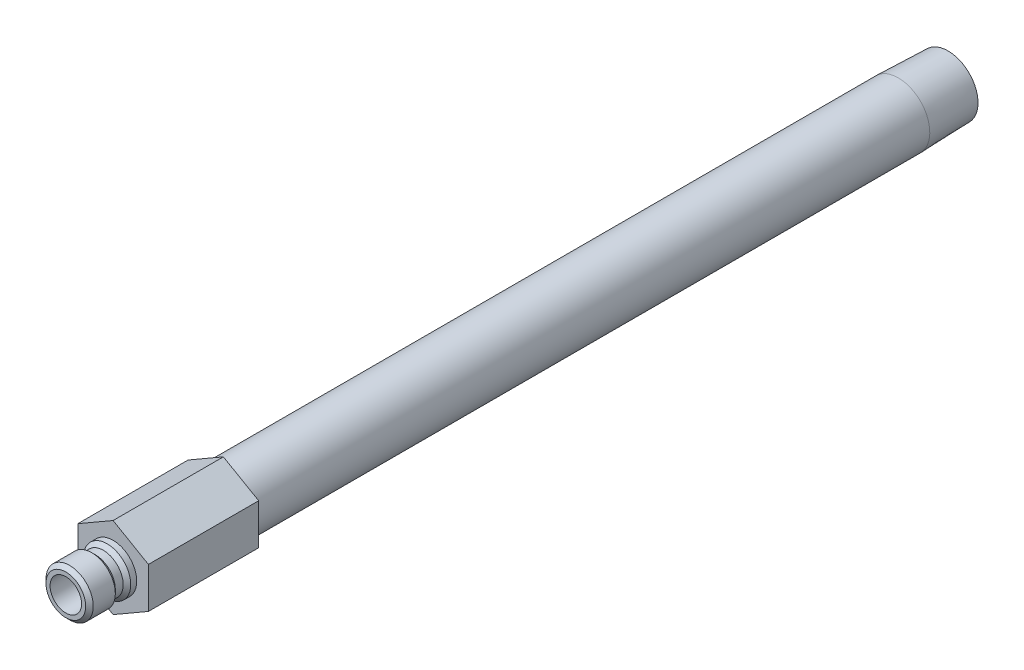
SolidWorks part; units mm, degrees
ref_plane "Front Plane" through (0, 0, 0) normal (0, 0, 1) x (1, 0, 0)
ref_plane "Top Plane" through (0, 0, 0) normal (0, 1, 0) x (1, 0, 0)
ref_plane "Right Plane" through (0, 0, 0) normal (1, 0, 0) x (0, 0, -1)
sketch "Sketch1" plane through (0, 0, 0) normal (1, 0, 0) x (0, 0, -1)
  line L0 (0, 0) -> (-12.7, 0) construction
  line L1 (-9.525, 3.175) -> (-9.525, 4.0005)
  line L2 (-3.556, 4.0005) -> (-3.556, 0) construction
  line L3 (-8.763, 4.7625) -> (-4.318, 4.7625)
  line L4 (0, 6.35) -> (0, 0) construction
  line L5 (-3.556, 4.0005) -> (-1.9685, 4.0005)
  line L6 (-1.2065, 4.7625) -> (0, 4.7625)
  line L7 (0, 4.7625) -> (0, 6.35)
  line L8 (-3.556, 4.0005) -> (-4.318, 4.7625)
  line L9 (-1.9685, 4.0005) -> (-1.2065, 4.7625)
  line L10 (-9.525, 4.0005) -> (-8.763, 4.7625)
  line L11 (22.225, 4.6228) -> (168.275, 4.6228)
  line L12 (0, 6.35) -> (158.242, 6.35)
  line L13 (158.242, 6.35) -> (168.275, 6.0365)
  line L14 (168.275, 6.0365) -> (168.275, 4.6228)
  line L15 (0, 0) -> (22.225, 0) construction
  line L16 (22.225, 0) -> (22.225, 4.7625) construction
  line L17 (22.225, 4.7625) -> (0, 4.7625) construction
  line L18 (22.225, 4.6228) -> (22.225, 3.175)
  line L19 (22.225, 3.175) -> (-9.525, 3.175)
  dimension "D1" = 9.525
  dimension "D2" = 1.5875
  dimension "D3" = 0.762
  dimension "D4" = 45
  dimension "D5" = 5.969
  dimension "D6" = 45
  dimension "D7" = 1.79
  dimension "D8" = 10.033
  dimension "D9" = 177.8
  dimension "D10" = 3.175
  dimension "D11" = 31.75
  dimension "D12" = 9.2456
  dimension "D13" = 6.35
  dimension "D14" = 9.525
  dimension "D15" = 12.7
revolve "Revolve1" add sketch "Sketch1" angle 360 about L0
sketch "Sketch2" plane through (0, 0, 0) normal (0, 0, 1) x (1, 0, 0)
  line L1 (-7.112, 4.1061) -> (-7.112, -4.1061)
  line L2 (-7.112, -4.1061) -> (0, -8.2122)
  line L3 (0, -8.2122) -> (7.112, -4.1061)
  line L4 (7.112, -4.1061) -> (7.112, 4.1061)
  line L5 (7.112, 4.1061) -> (0, 8.2122)
  line L6 (0, 8.2122) -> (-7.112, 4.1061)
  circle A0 centre (0, 0) radius 7.112 construction
  circle A1 centre (0, 0) radius 3.175 construction
  circle A2 centre (0, 0) radius 3.175
  dimension "D1" = 14.224
extrude "Boss-Extrude1" add sketch "Sketch2" against normal up to vertex (22.225 mm away) from vertex at 0
